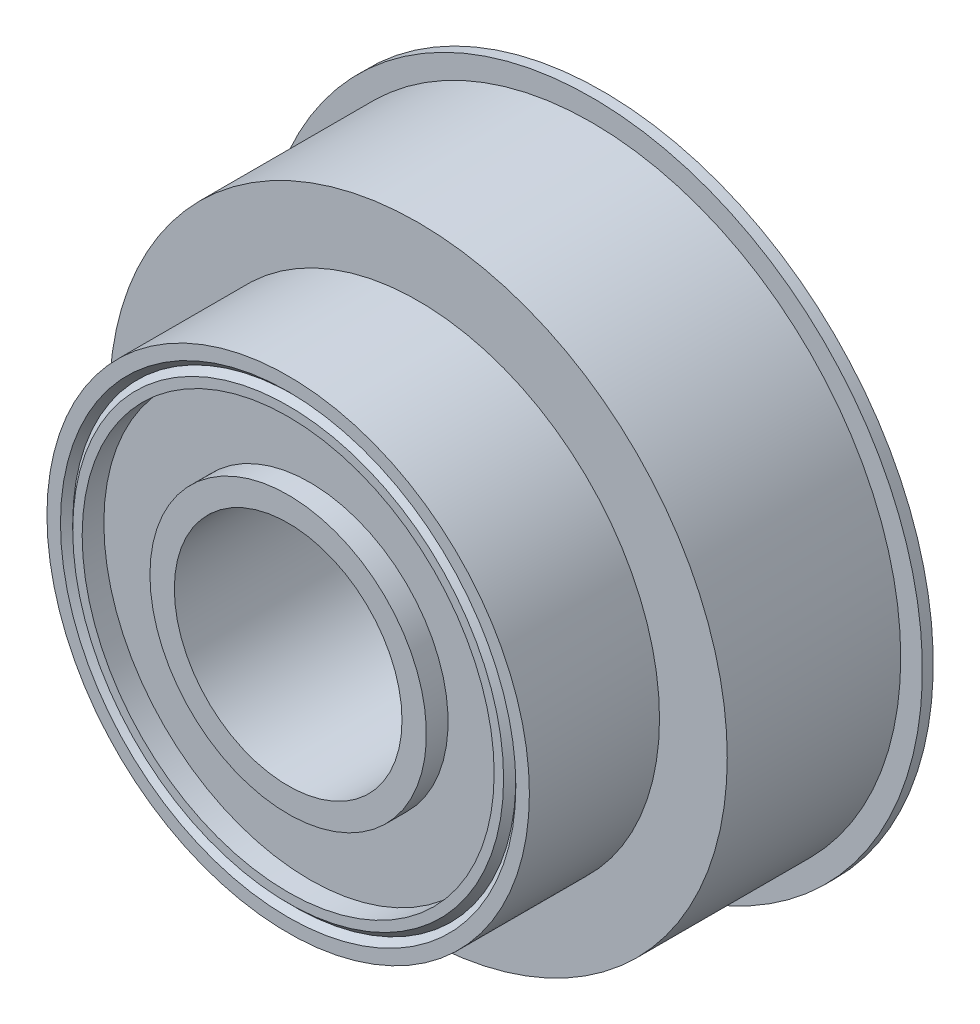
SolidWorks part; units mm, degrees
ref_plane "Front" through (0, 0, 0) normal (0, 0, 1) x (1, 0, 0)
ref_plane "Top" through (0, 0, 0) normal (0, 1, 0) x (1, 0, 0)
ref_plane "Right" through (0, 0, 0) normal (1, 0, 0) x (0, 0, -1)
ref_axis "Axis1" through (0, 0, -80.9) along (0, 0, 1)
sketch "Sketch1" plane through (0, 0, 0) normal (1, 0, 0) x (0, 0, -1)
  line L0 (0, 10.5) -> (0, 12.75)
  line L1 (0, 12.75) -> (2, 12.75)
  line L2 (2, 12.75) -> (2, 19)
  line L3 (2, 19) -> (0, 19)
  line L4 (0, 19) -> (0, 19.8699)
  line L5 (0, 19.8699) -> (0.565, 20.435)
  line L6 (0.565, 20.435) -> (0, 21)
  line L7 (0, 21) -> (0, 22.25)
  line L8 (0, 22.25) -> (12, 22.25)
  line L9 (12, 22.25) -> (12, 28.5)
  line L10 (12, 28.5) -> (28, 28.5)
  line L11 (28, 28.5) -> (28, 30.5)
  line L12 (28, 30.5) -> (29, 30.5)
  line L13 (29, 30.5) -> (29, 26.5)
  line L14 (29, 26.5) -> (28.5, 26.5)
  line L15 (28.5, 26.5) -> (28.5, 17.5)
  line L16 (28.5, 17.5) -> (22.2707, 17.5)
  line L17 (22.2707, 17.5) -> (19.7707, 15)
  line L18 (19.7707, 15) -> (19.7707, 10.5)
  line L19 (19.7707, 10.5) -> (0, 10.5)
  dimension "D1" = 28.5
  dimension "D2" = 1
  dimension "D3" = 0.5
  dimension "D4" = 22.25
  dimension "D5" = 1.25
  dimension "D6" = 3.25
  dimension "D7" = 2
  dimension "D8" = 12.75
  dimension "D9" = 10.5
  dimension "D10" = 30.5
  dimension "D11" = 4
  dimension "D12" = 17.5
  dimension "D13" = 16
  dimension "D14" = 12
  dimension "D15" = 29
revolve "Revolve1" add sketch "Sketch1" angle 360 about axis through (0, 0, -80.9) along (0, 0, 1)
